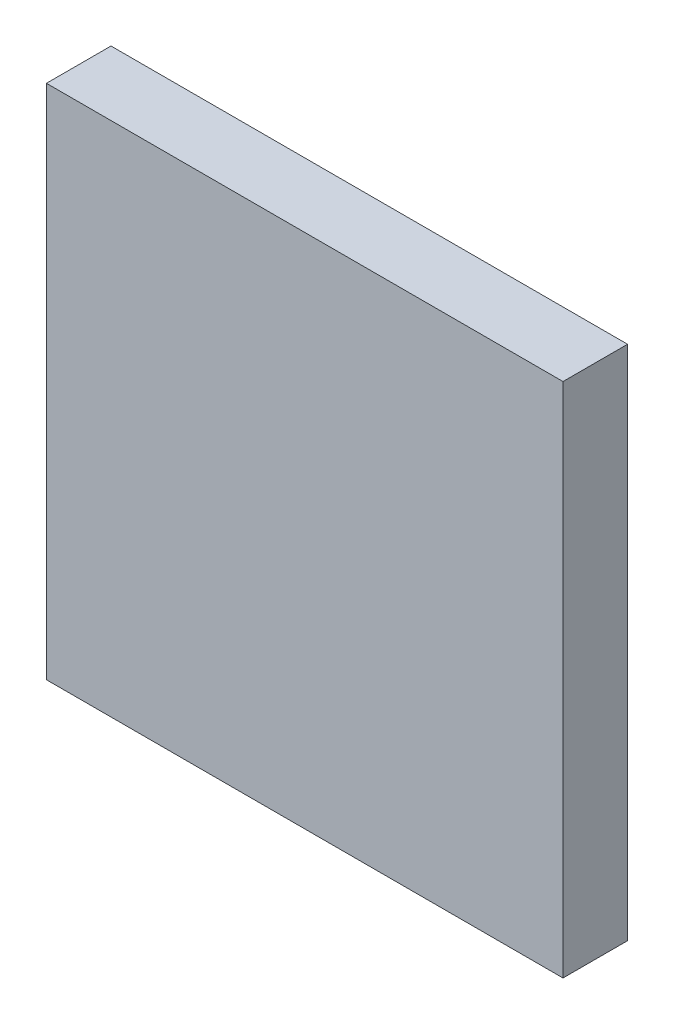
SolidWorks part; units mm, degrees
ref_plane "Front" through (0, 0, 0) normal (0, 0, 1) x (1, 0, 0)
ref_plane "Top" through (0, 0, 0) normal (0, 1, 0) x (1, 0, 0)
ref_plane "Side" through (0, 0, 0) normal (1, 0, 0) x (0, 0, -1)
sketch "Sketch1" plane through (0, 0, 0) normal (1, 0, 0) x (0, 0, -1)
  line L0 (-9.525, -76.2) -> (9.525, -76.2)
  line L1 (-9.525, -76.2) -> (-9.525, 76.2)
  line L2 (9.525, 76.2) -> (-9.525, 76.2)
  line L3 (9.525, 76.2) -> (9.525, -76.2)
  line L4 (-9.525, -76.2) -> (9.525, 76.2) construction
  dimension "D1" = 152.4
  dimension "D2" = 19.05
extrude "BasePlate" add sketch "Sketch1" along normal mid plane 152.4
